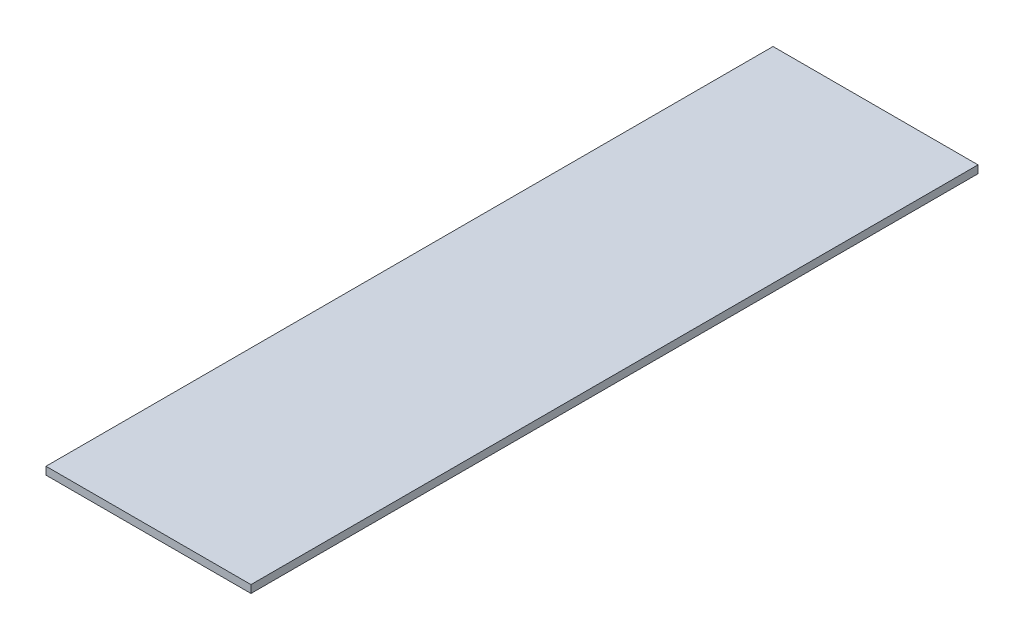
SolidWorks part; units mm, degrees
ref_plane "Front Plane" through (0, 0, 0) normal (0, 0, 1) x (1, 0, 0)
ref_plane "Top Plane" through (0, 0, 0) normal (0, 1, 0) x (1, 0, 0)
ref_plane "Right Plane" through (0, 0, 0) normal (1, 0, 0) x (0, 0, -1)
sketch "Sketch1" plane through (0, 0, 0) normal (0, 0, 1) x (1, 0, 0)
  line L1 (-265, -10) -> (265, -10)
  line L2 (-265, -10) -> (-265, 10)
  line L3 (-265, 10) -> (265, 10)
  line L4 (265, -10) -> (265, 10)
  line L5 (-265, -10) -> (265, 10) construction
  line L6 (-265, 10) -> (265, -10) construction
  point P0 (0, 0)
  dimension "D1" = 530
  dimension "D2" = 20
extrude "Boss-Extrude1" add sketch "Sketch1" along normal mid plane 1880
